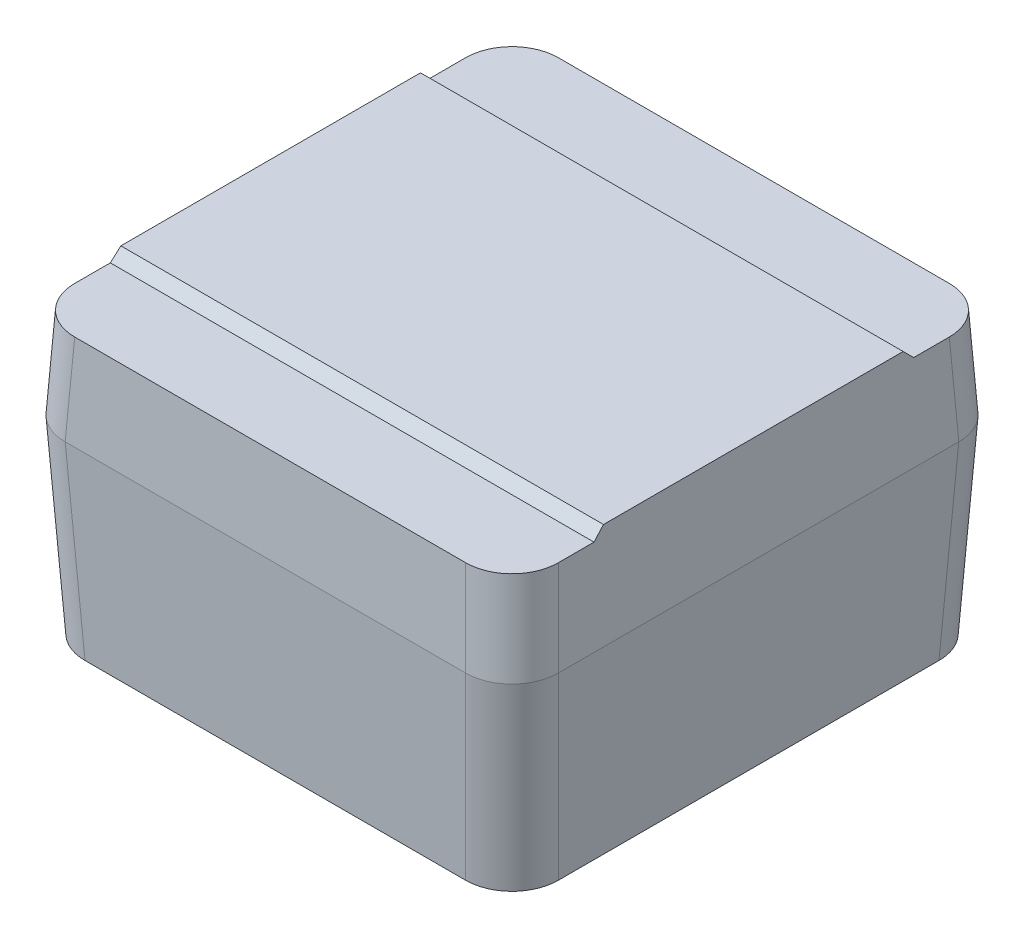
SolidWorks part; units mm, degrees
ref_plane "Front" through (0, 0, 0) normal (0, 0, 1) x (1, 0, 0)
ref_plane "Top" through (0, 0, 0) normal (0, 1, 0) x (1, 0, 0)
ref_plane "Right" through (0, 0, 0) normal (1, 0, 0) x (0, 0, -1)
sketch "Sketch1" plane through (0, 0, 0) normal (0, 1, 0) x (1, 0, 0)
  line L1 (4.3815, -4.3815) -> (-4.3815, -4.3815)
  line L2 (4.3815, -4.3815) -> (4.3815, 4.3815)
  line L3 (4.3815, 4.3815) -> (-4.3815, 4.3815)
  line L4 (-4.3815, -4.3815) -> (-4.3815, 4.3815)
  line L5 (4.3815, -4.3815) -> (-4.3815, 4.3815) construction
  line L6 (4.3815, 4.3815) -> (-4.3815, -4.3815) construction
  point P0 (0, 0)
  dimension "D1" = 8.763
  dimension "D2" = 8.763
extrude "Boss-Extrude1" add sketch "Sketch1" along normal blind 1.7907 draft 3
sketch "Sketch2" plane through (0, 0, 0) normal (0, -1, 0) x (1, 0, 0)
  line L1 (4.3815, -4.3815) -> (-4.3815, -4.3815)
  line L2 (4.3815, -4.3815) -> (4.3815, 4.3815)
  line L3 (4.3815, 4.3815) -> (-4.3815, 4.3815)
  line L4 (-4.3815, -4.3815) -> (-4.3815, 4.3815)
  line L5 (4.3815, -4.3815) -> (-4.3815, 4.3815) construction
  line L6 (4.3815, 4.3815) -> (-4.3815, -4.3815) construction
  point P0 (0, 0)
extrude "Boss-Extrude2" add sketch "Sketch2" along normal blind 3.3655 draft 3
fillet "Fillet2" radius 0.8255 8 edges at (4.2933, -1.6827, 4.2933) (4.3346, 0.8953, 4.3346) (4.2933, -1.6827, -4.2933) (4.3346, 0.8953, -4.3346) (-4.2933, -1.6827, -4.2933) (-4.3346, 0.8953, -4.3346) (-4.2933, -1.6827, 4.2933) (-4.3346, 0.8953, 4.3346)
sketch "Sketch4" plane through (0, 1.7907, 0) normal (0, 1, 0) x (1, 0, 0)
  line L0 (-4.2877, 0) -> (4.2877, 0) construction
  line L1 (-4.2877, 3.4633) -> (-4.2877, -3.4633) construction
  line L2 (4.2877, -3.4633) -> (4.2877, 3.4633) construction
  line L3 (0, -4.2877) -> (0, 4.2877) construction
  line L4 (-3.4633, -4.2877) -> (3.4633, -4.2877) construction
  line L5 (3.4633, 4.2877) -> (-3.4633, 4.2877) construction
  line L6 (5.08, 5.7355) -> (-5.08, 2.8399) construction
  line L7 (5.08, -2.8399) -> (-5.08, -2.8399)
  line L8 (5.08, -2.8399) -> (5.08, -5.7355)
  line L9 (5.08, -5.7355) -> (-5.08, -5.7355)
  line L10 (-5.08, -2.8399) -> (-5.08, -5.7355)
  line L11 (5.08, -2.8399) -> (-5.08, -5.7355) construction
  line L12 (5.08, -5.7355) -> (-5.08, -2.8399) construction
  line L13 (5.08, 2.8399) -> (-5.08, 5.7355) construction
  line L14 (-5.08, 2.8399) -> (-5.08, 5.7355)
  line L15 (5.08, 5.7355) -> (-5.08, 5.7355)
  line L16 (5.08, 2.8399) -> (5.08, 5.7355)
  line L17 (5.08, 2.8399) -> (-5.08, 2.8399)
  dimension "D1" = 2.8956
  dimension "D2" = 10.16
extrude "Cut-Extrude2" cut sketch "Sketch4" against normal blind 0.1778
chamfer "Chamfer2" distance 0.1778 angle 45 2 edges at (0, 1.7907, -2.8399) (0, 1.7907, 2.8399)
equation "\"D1@Boss-Extrude1\"=.088+.0025-.020"
